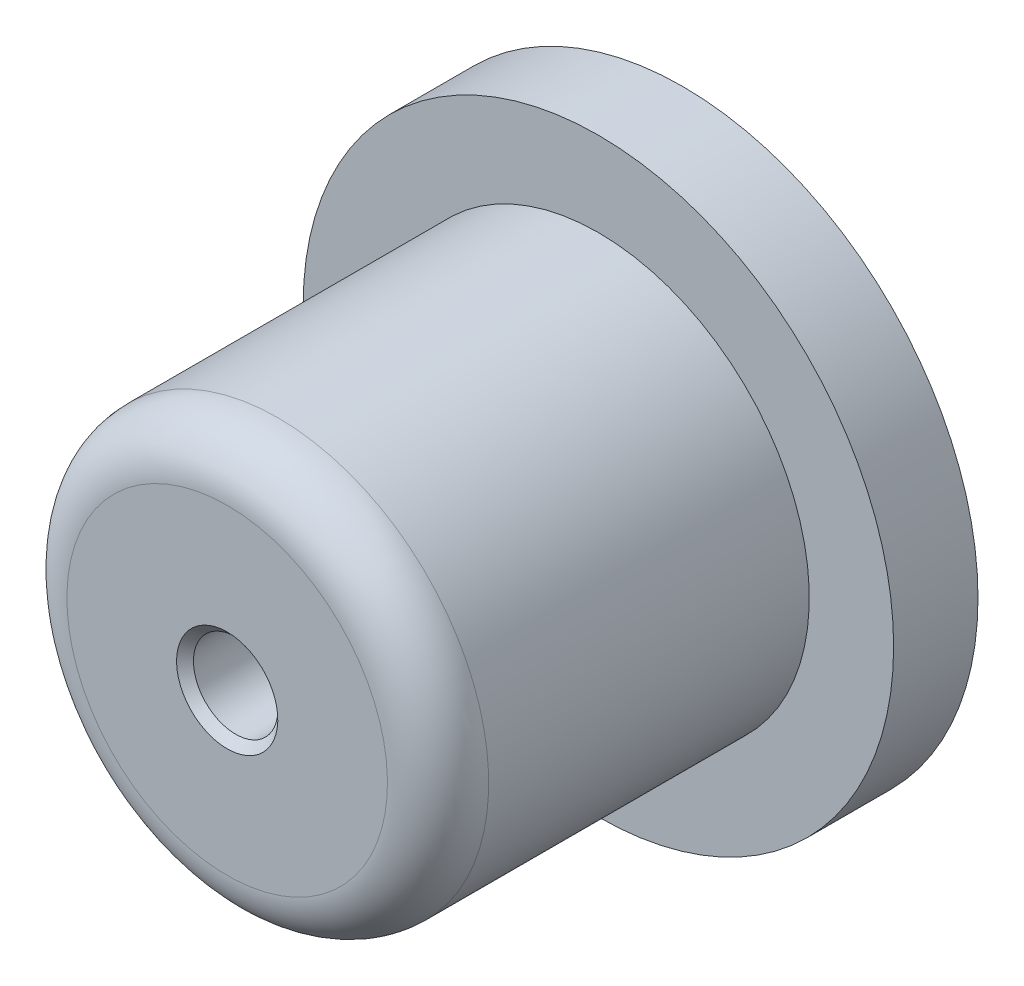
SolidWorks part; units mm, degrees
ref_plane "Front Plane" through (0, 0, 0) normal (0, 0, 1) x (1, 0, 0)
ref_plane "Top Plane" through (0, 0, 0) normal (0, 1, 0) x (1, 0, 0)
ref_plane "Right Plane" through (0, 0, 0) normal (1, 0, 0) x (0, 0, -1)
sketch "Sketch1" plane through (0, 0, 0) normal (1, 0, 0) x (0, 0, -1)
  line L0 (0, 0) -> (-25, 0) construction
  line L1 (0, 0) -> (0, 17.5)
  line L2 (0, 17.5) -> (-5, 17.5)
  line L3 (-5, 17.5) -> (-5, 12.5)
  line L4 (-5, 12.5) -> (-24, 12.5)
  line L5 (-27, 9.5) -> (-27, 3)
  line L6 (-26.5, 2.5) -> (-21, 2.5)
  line L7 (-21, 2.5) -> (-19.2495, 0)
  line L8 (-26.5, 2.5) -> (-27, 3)
  line L9 (0, 0) -> (-19.2495, 0)
  arc A0 (-24, 12.5) -> (-27, 9.5) centre (-24, 9.5) ccw
  dimension "D5" = 3
  dimension "D1" = 5
  dimension "D2" = 22
  dimension "D3" = 17.5
  dimension "D4" = 12.5
  dimension "D6" = 2.5
  dimension "D7" = 0.5
  dimension "D8" = 55
  dimension "D9" = 45
  dimension "D10" = 6
revolve "Revolve1" add sketch "Sketch1" angle 360 about L0
